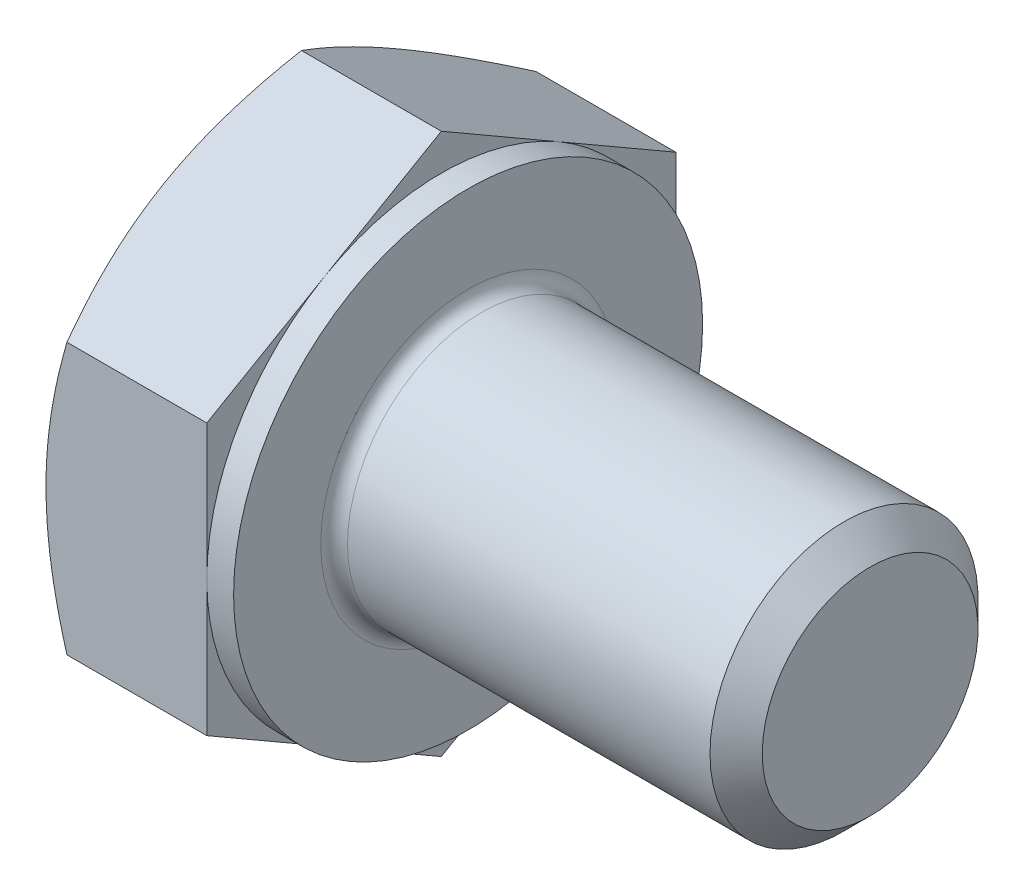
SolidWorks part; units mm, degrees
extrude "BaseHead" add sketch "Sketch1" along normal blind 2.8
sketch "Sketch1" plane through (0, 0, 0) normal (1, 0, 0) x (0, 0, -1)
  line L0 (3.5, 2.0207) -> (3.5, -2.0207)
  line L1 (-3.5, 2.0207) -> (-3.5, -2.0207)
  line L2 (3.5, -2.0207) -> (0, -4.0415)
  line L3 (0, -4.0415) -> (-3.5, -2.0207)
  line L4 (3.5, 2.0207) -> (0, 4.0415)
  line L5 (0, 4.0415) -> (-3.5, 2.0207)
revolve "HeadChamfer" cut sketch "Sketch3" angle 360 about L6
sketch "Sketch3" plane through (0, 0, 0) normal (0, 0, 1) x (1, 0, 0)
  line L0 (0, 3.5) -> (3.1994, 9.0415)
  line L1 (0, 4.0415) -> (0, 2.0207) construction
  line L2 (3.1994, 9.0415) -> (3.1994, 14.0415)
  line L3 (3.1994, 14.0415) -> (-10, 14.0415)
  line L4 (-10, 14.0415) -> (-10, 3.5)
  line L5 (-10, 3.5) -> (0, 3.5)
  line L6 (0, 0) -> (99.06, 0) construction
  line L7 (2.8, 4.0415) -> (0, 4.0415) construction
ref_plane "Plane1" through (0, 0, 0) normal (0, 0, 1) x (1, 0, 0)
ref_plane "Plane2" through (0, 0, 0) normal (0, 1, 0) x (1, 0, 0)
ref_plane "Plane3" through (0, 0, 0) normal (1, 0, 0) x (0, 0, -1)
sketch "BodySke" plane through (0, 0, 0) normal (0, 0, 1) x (1, 0, 0)
  line L0 (0, 2.0207) -> (0, -2.0207) construction
  line L1 (0, 0) -> (8.8, 0)
  line L2 (0, 0) -> (0, 2)
  line L3 (0, 2) -> (8.41, 2)
  line L4 (8.8, 0) -> (8.8, 1.61)
  line L5 (2.8, 4.0415) -> (2.8, 2.0207) construction
  line L6 (8.8, 1.61) -> (8.41, 2)
  line L7 (0, 0) -> (96.52, 0) construction
  line L8 (8.8, -1.61) -> (8.41, -2) construction
  line L9 (0, -2) -> (8.41, -2) construction
  line L10 (3.5, 15.24) -> (3.5, -1.27) construction
  line L12 (2.8, 2.0207) -> (2.8, -2.0207) construction
revolve "BaseBody" add sketch "BodySke"
fillet "HeadFillet" radius 0.2 1 edges at (2.8, 0, -2)
sketch "Sketch4" plane through (0, 0, 0) normal (0, 0, 1) x (1, 0, 0)
  line L1 (2.8, 4.0415) -> (2.8, 2.0207) construction
  line L2 (2.8, 3.5) -> (2.4, 3.5)
  line L3 (2.8, 3.5) -> (2.8, 14.0415)
  line L4 (2.8, 14.0415) -> (2.4, 14.0415)
  line L5 (0, 0) -> (95.25, 0) construction
  line L6 (0, 0) -> (96.52, 0) construction
  line L7 (2.4, 3.5) -> (2.4, 14.0415)
  line L8 (2.8, 4.0415) -> (0.3126, 4.0415) construction
revolve "BearingFace" cut sketch "Sketch4" angle 360 about L5
sketch "ThdSchSke" plane through (0, 0, 0) normal (0, 0, 1) x (1, 0, 0)
  line L0 (3.5, -1.61) -> (3.2269, -2)
  line L1 (3.5, -1.61) -> (3.7731, -2)
  line L2 (3.7731, -2) -> (3.7731, -2.5)
  line L3 (-3.175, 0) -> (5.1513, 0) construction
  line L5 (3.7731, -2.5) -> (3.2269, -2.5)
  line L6 (3.2269, -2.5) -> (3.2269, -2)
revolve "ThreadSchematic" [suppressed] cut sketch "ThdSchSke" angle 360 about L3
pattern_linear "ThdSchPat" [suppressed]
equation "\"D3@Sketch1\" = \"Width_flats@Sketch1\" / 2"
equation "\"D4@Sketch1\" = \"D3@Sketch1\""
equation "\"D5@Sketch1\" = \"D4@Sketch1\""
equation "\"Thread_minor@ThreadCosmetic\" = \"Minor_dia@BodySke\""
equation "\"D1@Sketch3\" = \"Width_flats@Sketch1\" / 2"
equation "\"D1@Sketch4\" = \"Width_flats@Sketch1\""
equation "\"Thread_length@ThreadCosmetic\" = \"Length@BodySke\" - \"Advance@BodySke\""
equation "\"Thread_minor@ThdSchSke\" = \"Minor_dia@BodySke\""
equation "\"Diameter@ThdSchSke\" = \"Diameter@BodySke\""
equation "\"Overcut@ThdSchSke\" = \"Diameter@BodySke\" * 1.25"
equation "\"Start@ThdSchSke\" = \"Head_ht@BaseHead\" + \"Length@BodySke\" - \"Thread_length@ThreadCosmetic\"  '---Non-countersunk---"
equation "\"Num_threads@ThdSchPat\" = int( \"Thread_length@ThreadCosmetic\" / \"Advance@BodySke\" + 0.999 )  + 1"
equation "\"Advance@ThdSchPat\" = \"Thread_length@ThreadCosmetic\" /  (\"Num_threads@ThdSchPat\" - 1) 'relax it"
equation "\"Num_threads@ThdSchPat\" = \"Num_threads@ThdSchPat\" - sgn( \"Num_threads@ThdSchPat\" - 1) '---chamfered tips only---"
